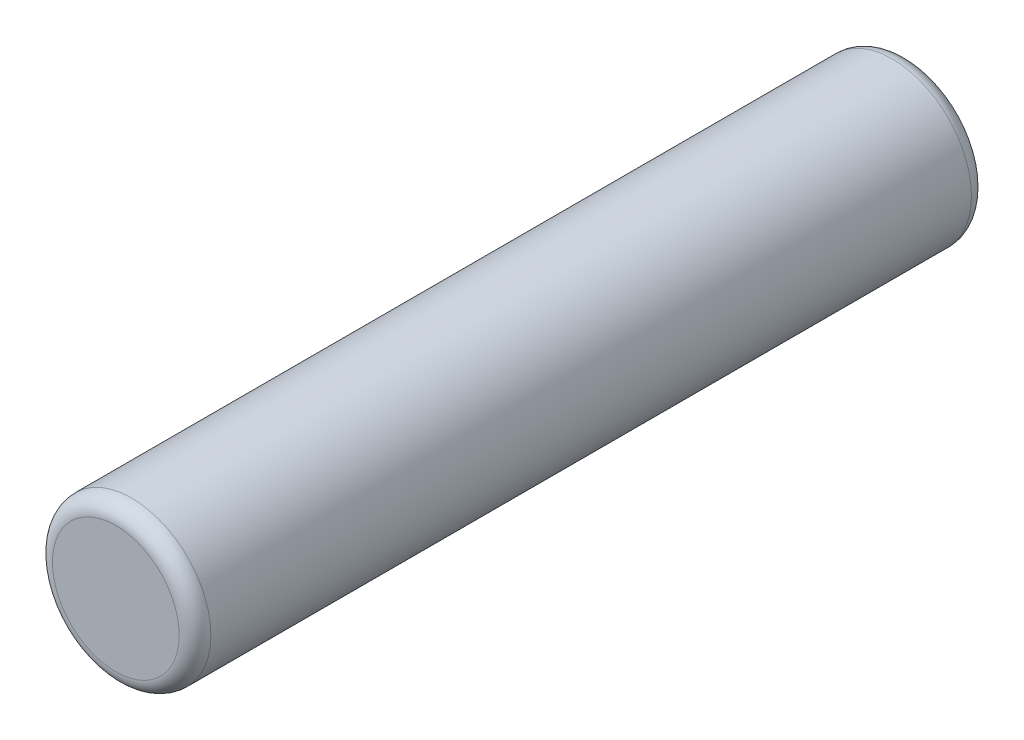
SolidWorks part; units mm, degrees
ref_plane "Plan de face" through (0, 0, 0) normal (0, 0, 1) x (1, 0, 0)
ref_plane "Plan de dessus" through (0, 0, 0) normal (0, 1, 0) x (1, 0, 0)
ref_plane "Plan de droite" through (0, 0, 0) normal (1, 0, 0) x (0, 0, -1)
sketch "Esquisse1" plane through (0, 0, 0) normal (0, 0, 1) x (1, 0, 0)
  circle A0 centre (0, 0) radius 10
  dimension "D1" = 20
extrude "Extrusion1" add sketch "Esquisse1" along normal blind 100
fillet "Congé3" radius 2 2 edges at (10, 0, 0) (10, 0, 100)
